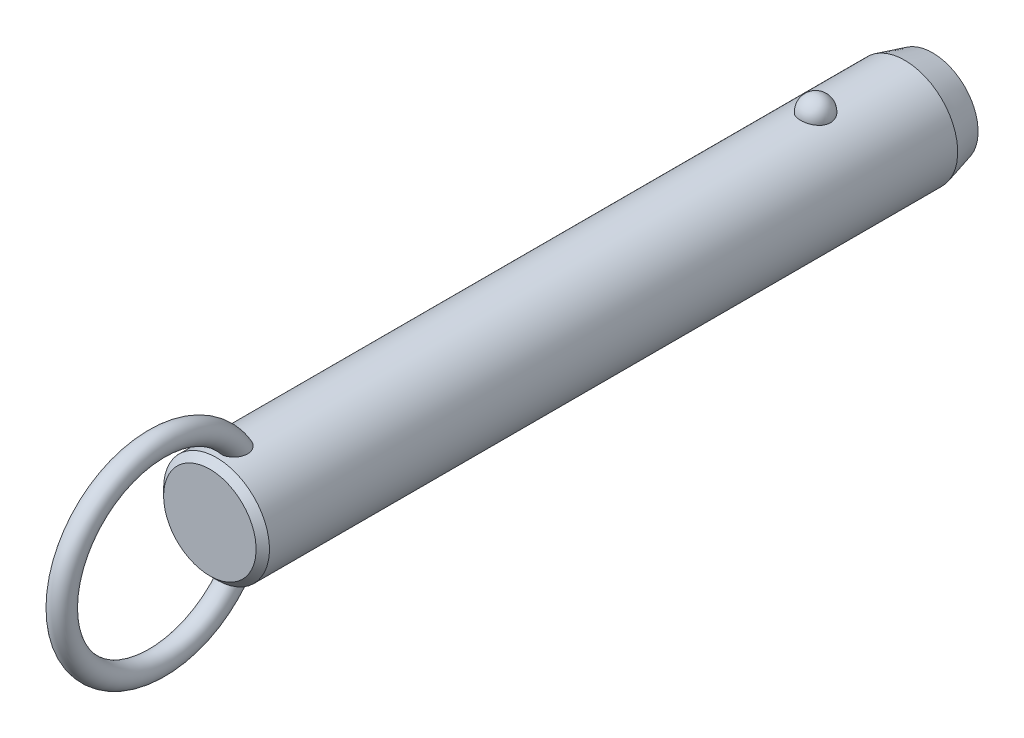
SolidWorks part; units mm, degrees
ref_plane "Front Plane" through (0, 0, 0) normal (0, 0, 1) x (1, 0, 0)
ref_plane "Top Plane" through (0, 0, 0) normal (0, 1, 0) x (1, 0, 0)
ref_plane "Right Plane" through (0, 0, 0) normal (1, 0, 0) x (0, 0, -1)
sketch "Sketch2" plane through (0, 0, 0) normal (0, 0, 1) x (1, 0, 0)
  circle A0 centre (0, 0) radius 9.5
  point P3 (0, 9.5)
  dimension "D1" = 19
extrude "Boss-Extrude1" add sketch "Sketch2" along normal blind 96.5
sketch "Sketch3" plane through (0, 0, 0) normal (0, 0, -1) x (-1, 0, 0)
  circle A0 centre (0, 0) radius 9.5
  dimension "D1" = 19
extrude "Boss-Extrude2" add sketch "Sketch3" along normal blind 23.7
chamfer "Chamfer1" distance 5 angle 15 1 edges at (-9.5, 0, -23.7)
sketch "Sketch12" plane through (0, 0, 0) normal (1, 0, 0) x (0, 0, -1)
  line L0 (-96.5, 9.5) -> (-96.5, -9.5) construction
  point P0 (-96.5, 0)
sketch "Sketch13" plane through (0, 0, 0) normal (1, 0, 0) x (0, 0, -1)
  circle A0 centre (-115.55, 0) radius 19.05
  point P2 (-96.5, 0)
  dimension "D1" = 38.1
sketch "Sketch14" plane through (0, 0, 0) normal (0, 1, 0) x (1, 0, 0)
  circle A0 centre (0, -98.5) radius 2
  point P2 (0, -96.5)
  dimension "D1" = 4
sweep "Sweep1" add profiles "Sketch14" path "Sketch13"
sketch "Sketch15" plane through (0, 0, 96.5) normal (0, 0, 1) x (1, 0, 0)
  circle A0 centre (0, 0) radius 9.5
  dimension "D1" = 19
extrude "Boss-Extrude3" add sketch "Sketch15" along normal blind 9.52
chamfer "Chamfer2" distance 1.2 angle 45 1 edges at (9.5, 0, 106.02)
sketch "Sketch18" plane through (0, 0, 0) normal (1, 0, 0) x (0, 0, -1)
  line L0 (18.7, 9.5) -> (-99.0378, 9.5) construction
  line L1 (2.7, 12.2) -> (2.7, 6.8)
  line L2 (-99.0378, -9.5) -> (18.7, -9.5) construction
  arc A0 (2.7, 12.2) -> (2.7, 6.8) centre (2.7, 9.5) ccw
  point P4 (0, 9.5)
  dimension "D1" = 21.7
revolve "Revolve1" add sketch "Sketch18" angle 360 about L1
